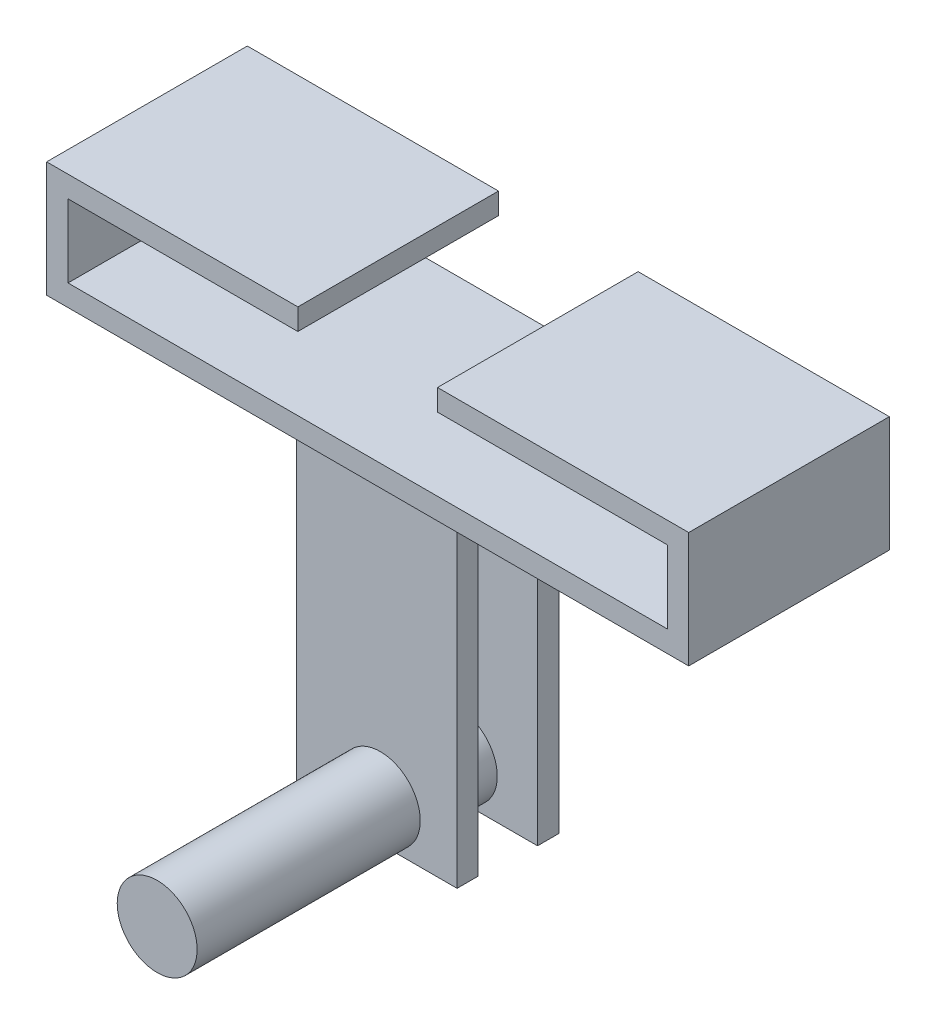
SolidWorks part; units mm, degrees
ref_plane "Front Plane" through (0, 0, 0) normal (0, 0, 1) x (1, 0, 0)
ref_plane "Top Plane" through (0, 0, 0) normal (0, 1, 0) x (1, 0, 0)
ref_plane "Right Plane" through (0, 0, 0) normal (1, 0, 0) x (0, 0, -1)
sketch "Sketch1" plane through (0, 0, 0) normal (0, 1, 0) x (1, 0, 0)
  line L1 (0, 0) -> (101.6, 0)
  line L2 (0, 0) -> (0, 31.75)
  line L3 (0, 31.75) -> (101.6, 31.75)
  line L4 (101.6, 0) -> (101.6, 31.75)
extrude "Boss-Extrude1" add sketch "Sketch1" along normal blind 18.288 contours L3 L4 L1 L2
sketch "Sketch2" plane through (0, 18.288, 0) normal (0, 1, 0) x (1, 0, 0)
  line L0 (0, 31.75) -> (101.6, 31.75) construction
  line L4 (39.751, 0) -> (39.751, 31.75)
  line L5 (0, 0) -> (101.6, 0) construction
  line L9 (61.849, 31.75) -> (61.849, 0)
  line L11 (39.751, 0) -> (61.849, 0)
  line L13 (39.751, 31.75) -> (61.849, 31.75)
extrude "Cut-Extrude1" cut sketch "Sketch2" against normal blind 14.9098
sketch "Sketch3" plane through (0, 0, 0) normal (0, 0, 1) x (1, 0, 0)
  line L0 (50.8, 3.3782) -> (50.8, 29.1234) construction
  line L1 (39.751, 3.3782) -> (3.3782, 3.3782)
  line L2 (39.751, 3.3782) -> (39.751, 14.9098)
  line L3 (39.751, 14.9098) -> (3.3782, 14.9098)
  line L4 (3.3782, 3.3782) -> (3.3782, 14.9098)
  line L5 (39.751, 3.3782) -> (61.849, 3.3782) construction
  line L6 (50.8, 29.1234) -> (50.8, -16.1656) construction
  line L7 (61.849, 14.9098) -> (98.2218, 14.9098)
  line L8 (98.2218, 3.3782) -> (98.2218, 14.9098)
  line L9 (61.849, 3.3782) -> (98.2218, 3.3782)
  line L10 (61.849, 3.3782) -> (61.849, 14.9098)
  dimension "D1" = 3.3782
  dimension "D2" = 3.3782
extrude "Cut-Extrude2" cut sketch "Sketch3" against normal through all
sketch "Sketch4" plane through (0, 0, 0) normal (0, -1, 0) x (1, 0, 0)
  line L0 (0, 0) -> (101.6, 0) construction
  line L1 (63.4898, -17.5641) -> (38.1102, -17.5641)
  line L2 (63.4898, -17.5641) -> (63.4898, -14.1859)
  line L3 (63.4898, -14.1859) -> (38.1102, -14.1859)
  line L4 (38.1102, -17.5641) -> (38.1102, -14.1859)
  line L5 (0, 0) -> (0, -31.75) construction
  point P4 (0, -15.875)
  point P5 (50.8, 0)
  point P6 (50.8, -14.1859)
  point P11 (38.1102, -15.875)
extrude "Boss-Extrude2" add sketch "Sketch4" along normal blind 50.8
sketch "Sketch5" plane through (0, 0, -14.1859) normal (0, 0, 1) x (1, 0, 0)
  line L0 (44.4754, -44.45) -> (57.1246, -44.45)
  arc A0 (57.1246, -44.45) -> (44.4754, -44.45) centre (50.8, -44.45) ccw
extrude "Boss-Extrude3" add sketch "Sketch5" along normal blind 47.498 contours L0 A0
sketch "Sketch8" plane through (0, 0, -14.1859) normal (0, 0, 1) x (1, 0, 0)
  line L0 (44.4754, -44.45) -> (57.1246, -44.45) construction
  line L1 (44.4754, -44.45) -> (57.1246, -44.45)
  arc A0 (44.4754, -44.45) -> (57.1246, -44.45) centre (50.8, -44.45) ccw
extrude "Boss-Extrude4" add sketch "Sketch8" along normal blind 47.498
sketch "Sketch10" plane through (0, 0, 0) normal (0, -1, 0) x (1, 0, 0)
  line L1 (37.5522, -5.2959) -> (62.9522, -5.2959)
  line L2 (37.5522, -5.2959) -> (37.5522, -1.9939)
  line L3 (37.5522, -1.9939) -> (62.9522, -1.9939)
  line L4 (62.9522, -5.2959) -> (62.9522, -1.9939)
extrude "Boss-Extrude5" add sketch "Sketch10" along normal up to vertex (50.8 mm away)
equation "\"a\"= 1.006"
equation "\"b\"=0.9992"
equation "\"c\"= 0.133"
equation "\"d\"= 0.050"
equation "\"e\"=0.498"
equation "\"Overall Width\"= 4"
equation "\"width\"= 1.25"
equation "\"cylindrical diameter\"= 1.50"
equation "\"c beam length\"= 4'd"
equation "\"d beam length\"= 1"
equation "\"d beam width\"= 1.25"
equation "\"D1@Sketch1\"=\"Overall Width\""
equation "\"D2@Sketch1\"=\"width\""
equation "\"depth\"= 0.720"
equation "\"D1@Boss-Extrude1\"=\"depth\""
equation "\"cut length\"= 0.87"
equation "\"D1@Sketch2\"=\"cut length\""
equation "\"D1@Sketch4\"=\"b\""
equation "\"D2@Sketch4\"=\"c\""
equation "\"D1@Sketch5\"=\"e\""
equation "\"D1@Sketch10\"=.13"
